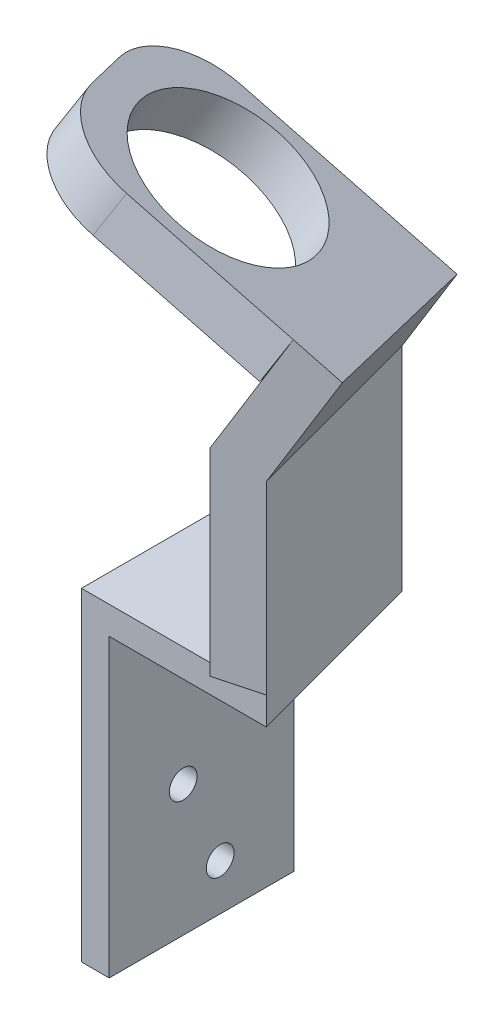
SolidWorks part; units mm, degrees
ref_plane "前视基准面" through (0, 0, 0) normal (0, 0, 1) x (1, 0, 0)
ref_plane "上视基准面" through (0, 0, 0) normal (0, 1, 0) x (1, 0, 0)
ref_plane "右视基准面" through (0, 0, 0) normal (1, 0, 0) x (0, 0, -1)
sketch "草图5" plane through (0, 0, 0) normal (0, 0, 1) x (1, 0, 0)
  line L0 (0, 0) -> (0, 35)
  line L2 (3, 32) -> (3, 0)
  line L3 (3, 0) -> (0, 0)
  line L4 (0, 35) -> (20, 35)
  line L5 (20, 35) -> (20, 32)
  line L6 (20, 32) -> (3, 32)
  dimension "D1" = 90
  dimension "D2" = 3
  dimension "D3" = 20
  dimension "D4" = 3
  dimension "D5" = 35
extrude "凸台-拉伸3" add sketch "草图5" along normal blind 20
sketch "草图6" plane through (0, 0, 0) normal (-1, 0, 0) x (0, 0, 1)
  line L0 (0, 35) -> (0, 0) construction
  line L2 (20, 0) -> (0, 0) construction
  line L4 (20, 35) -> (20, 0) construction
  circle A0 centre (12, 14.1652) radius 1.5
  circle A1 centre (8, 5) radius 1.5
  dimension "D1" = 3
  dimension "D2" = 3
  dimension "D3" = 10
  dimension "D4" = 5
  dimension "D5" = 12
  dimension "D6" = 12
extrude "切除-拉伸3" cut sketch "草图6" against normal blind 20
sketch "草图7" plane through (0, 35, 0) normal (0, 1, 0) x (1, 0, 0)
  line L0 (20, -20) -> (14.641, 0)
  line L1 (20, 0) -> (0, 0) construction
  line L2 (14.641, 0) -> (9.8114, -1.2941)
  line L3 (9.8114, -1.2941) -> (15.1704, -21.2941)
  line L4 (15.1704, -21.2941) -> (20, -20)
  dimension "D1" = 5
  dimension "D2" = 105
extrude "凸台-拉伸4" add sketch "草图7" along normal blind 20
sketch "草图9" plane through (6.3397, 0, 23.6603) normal (0.2588, 0, 0.9659) x (0.9659, 0, -0.2588)
  line L0 (14.1421, 55) -> (26.6421, 76.6506)
  line L1 (26.6421, 76.6506) -> (22.312, 79.1506)
  line L2 (22.312, 79.1506) -> (9.1421, 56.3397)
  line L3 (14.1421, 55) -> (14.1421, 35) construction
  line L4 (9.1421, 55) -> (9.1421, 56.3397)
  line L5 (9.1421, 55) -> (14.1421, 55)
  dimension "D1" = 150
  dimension "D2" = 5
  dimension "D3" = 25
extrude "凸台-拉伸6" add sketch "草图9" against normal up to surface (20.7055 mm away)
sketch "草图10" plane through (-16.9416, 10.1263, 4.5395) normal (-0.8365, 0.5, 0.2241) x (0.1924, -0.115, 0.9746)
  line L0 (15.2326, 70.7684) -> (-4.8048, 64.4004)
  line L1 (13.6944, 82.2493) -> (17.192, 56.1428) construction
  line L2 (-3.3301, 53.3933) -> (-6.8277, 79.4998) construction
  line L3 (-4.8048, 64.4004) -> (-3.2904, 59.6352)
  line L4 (-3.2904, 59.6352) -> (16.747, 66.0033)
  line L5 (16.747, 66.0033) -> (15.2326, 70.7684)
  dimension "D1" = 80
  dimension "D2" = 5
extrude "凸台-拉伸7" add sketch "草图10" along normal blind 25
sketch "草图11" plane through (27.06, 53.5863, -18.546) normal (0.4307, 0.8529, -0.2952) x (0.9025, -0.407, 0.1409)
  line L0 (-13.1691, -21.4369) -> (-28.4496, -50.3083) construction
  circle A0 centre (-20.8093, -35.8726) radius 9
  dimension "D1" = 18
extrude "切除-拉伸4" cut sketch "草图11" against normal blind 22
sketch "草图12" plane through (0, 35, 0) normal (0, 1, 0) x (1, 0, 0)
  line L3 (14.641, 0) -> (20, -20)
  line L4 (20, -20) -> (20, 0)
  line L5 (20, 0) -> (14.641, 0)
  line L6 (14.641, 0) -> (20, -20)
  line L7 (20, -20) -> (20, 0)
  line L8 (20, 0) -> (14.641, 0)
  dimension "D1" = 0
extrude "切除-拉伸5" cut sketch "草图12" against normal blind 22
sketch "草图13" plane through (-16.9416, 10.1263, 4.5395) normal (-0.8365, 0.5, 0.2241) x (0.1924, -0.115, 0.9746)
  line L4 (-6.8277, 79.4998) -> (-4.8048, 64.4004)
  line L5 (-4.8048, 64.4004) -> (15.2326, 70.7684)
  line L6 (15.2326, 70.7684) -> (13.6944, 82.2493)
  line L7 (13.6944, 82.2493) -> (-6.8277, 79.4998)
  line L8 (-6.8277, 79.4998) -> (-4.8048, 64.4004)
  line L9 (-4.8048, 64.4004) -> (15.2326, 70.7684)
  line L10 (15.2326, 70.7684) -> (13.6944, 82.2493)
  line L11 (13.6944, 82.2493) -> (-6.8277, 79.4998)
  dimension "D1" = 0
extrude "切除-拉伸6" cut sketch "草图13" against normal blind 22
fillet "圆角1" radius 8 2 edges at (-6.8148, 76.3251, 6.1985) (0.3075, 79.4869, 25.726)
